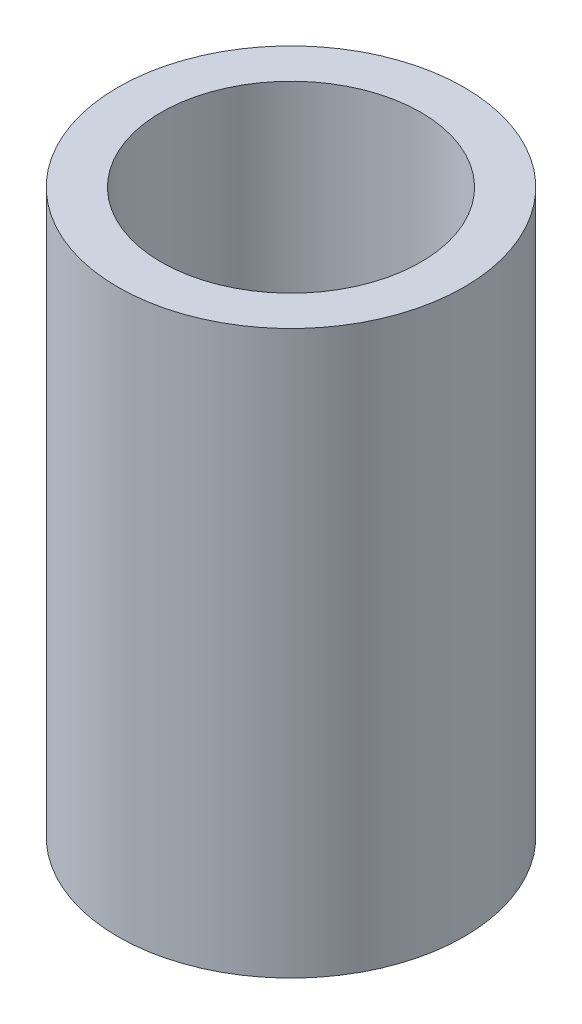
SolidWorks part; units mm, degrees
ref_plane "前视基准面" through (0, 0, 0) normal (0, 0, 1) x (1, 0, 0)
ref_plane "上视基准面" through (0, 0, 0) normal (0, 1, 0) x (1, 0, 0)
ref_plane "右视基准面" through (0, 0, 0) normal (1, 0, 0) x (0, 0, -1)
sketch "草图1" plane through (0, 0, 0) normal (0, 1, 0) x (1, 0, 0)
  circle A0 centre (0, 0) radius 9
  circle A1 centre (0, 0) radius 12
  dimension "D1" = 18
  dimension "D2" = 24
extrude "凸台-拉伸1" add sketch "草图1" along normal mid plane 39
